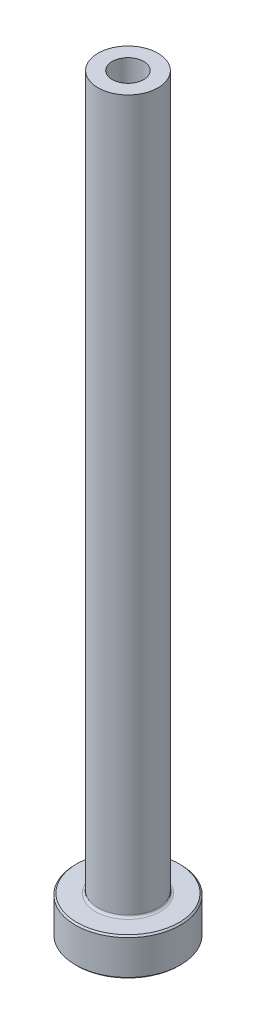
SolidWorks part; units mm, degrees
ref_plane "Front Plane" through (0, 0, 0) normal (0, 0, 1) x (1, 0, 0)
ref_plane "Top Plane" through (0, 0, 0) normal (0, 1, 0) x (1, 0, 0)
ref_plane "Right Plane" through (0, 0, 0) normal (1, 0, 0) x (0, 0, -1)
sketch "Sketch1" plane through (0, 0, 0) normal (0, 0, 1) x (1, 0, 0)
  line L0 (-2.1, 100) -> (-4, 100)
  line L1 (-4, 100) -> (-4, 5)
  line L2 (-4, 5) -> (-7, 5)
  line L3 (-7, 5) -> (-7, 0)
  line L4 (5.5, 0) -> (-5.5, 0) construction
  line L5 (-7, 0) -> (-2.35, 0)
  line L6 (-2.1, 55) -> (-2.1, 100)
  line L7 (0, 92.1877) -> (0, -15.5353) construction
  line L8 (0, -5.5) -> (0, 5.5) construction
  line L9 (-2.1, 55) -> (-2.35, 43)
  line L10 (-2.35, 43) -> (-2.35, 0)
  dimension "D1" = 0.25
  dimension "ID" = 4.2
  dimension "OD" = 8
  dimension "L" = 100
  dimension "H" = 14
  dimension "T" = 5
  dimension "N" = 45
  dimension "D2" = 12
revolve "Revolve1" add sketch "Sketch1" angle 360 about L7
fillet "Fillet1" radius 0.3 1 edges at (0, 5, 4)
chamfer "Chamfer1" distance 0.2 angle 45 2 edges at (0, 5, 7) (0, 0, 7)
chamfer "Chamfer3" distance 0.5 angle 45 1 edges at (0, 0, 2.35)
